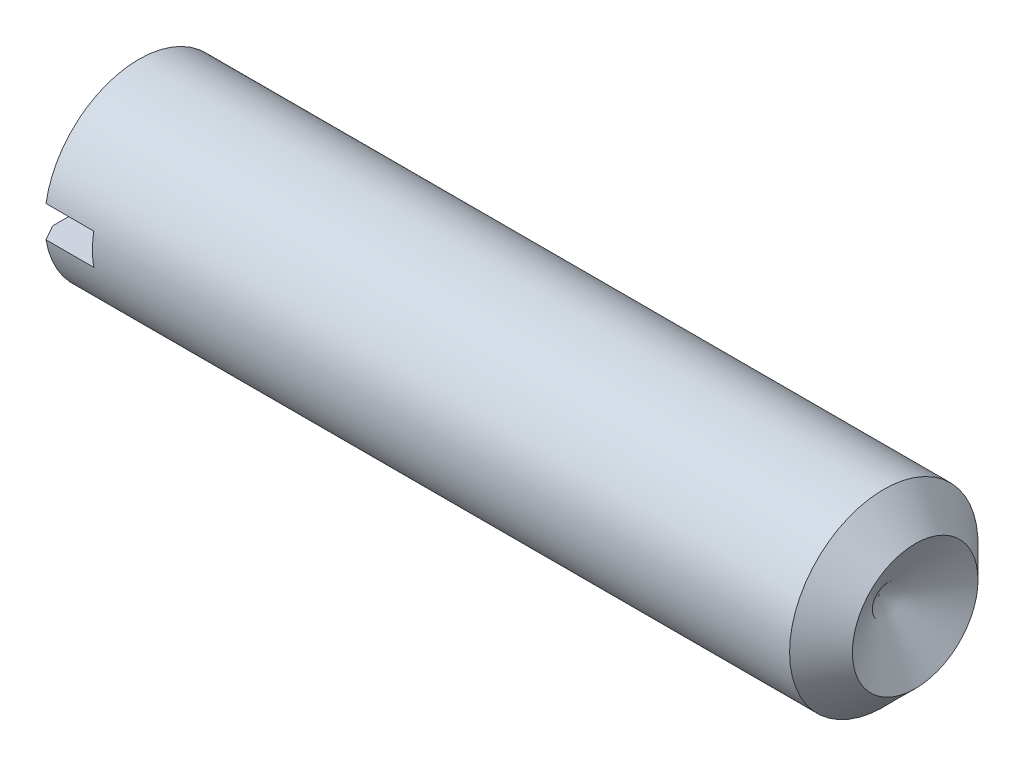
SolidWorks part; units mm, degrees
ref_plane "Plane1" through (0, 0, 0) normal (0, 0, 1) x (1, 0, 0)
ref_plane "Plane2" through (0, 0, 0) normal (0, 1, 0) x (1, 0, 0)
ref_plane "Plane3" through (0, 0, 0) normal (1, 0, 0) x (0, 0, -1)
sketch "BodySke" plane through (0, 0, 0) normal (0, 0, 1) x (1, 0, 0)
  line L0 (0.5566, -6) -> (47.1574, -6) construction
  line L1 (50, 4) -> (47.6906, 0)
  line L2 (0.5566, 6) -> (48, 6)
  line L3 (50, 4) -> (48, 6)
  line L4 (47.6906, 0) -> (0, 0)
  line L5 (-12.7, 0) -> (88.9, 0) construction
  line L6 (50, 4) -> (50, 19.05) construction
  line L7 (50, -4) -> (48, -6) construction
  line L8 (1.75, 12.7) -> (1.75, -3.175) construction
  line L9 (0, 0) -> (0, 5.036)
  line L10 (0, 5.036) -> (0.5566, 6)
  line L11 (0, -5.036) -> (0.5566, -6) construction
  line L12 (50, -4) -> (47.6906, 0) construction
  dimension "Length" = 50
  dimension "Diameter" = 12
  dimension "Drive_ch_ang" = 60
  dimension "Cup_ang" = 120
  dimension "Cup_dia" = 8
  dimension "Nose_ch_ang" = 45
  dimension "Advance" = 1.75
  dimension "Minor_dia" = 10.072
revolve "BaseBody" add sketch "BodySke"
extrude "Slot" cut sketch "Sketch2" along normal blind 3.6
sketch "Sketch2" plane through (0, 0, 0) normal (1, 0, 0) x (0, 0, -1)
  line L1 (6, -1) -> (-6, -1)
  line L2 (6, -1) -> (6, 1)
  line L3 (6, 1) -> (-6, 1)
  line L4 (-6, -1) -> (-6, 1)
  dimension "D1" = 12
  dimension "D2" = 1
  dimension "Slot_width" = 2
  dimension "D3" = 6
sketch "ThdSchSke" plane through (0, 0, 0) normal (0, 0, 1) x (1, 0, 0)
  line L0 (0.5566, -5.036) -> (-0.1184, -6)
  line L1 (0.5566, -5.036) -> (1.2316, -6)
  line L2 (1.2316, -6) -> (1.2316, -7.5)
  line L3 (-3.175, 0) -> (5.1513, 0) construction
  line L5 (1.2316, -7.5) -> (-0.1184, -7.5)
  line L6 (-0.1184, -7.5) -> (-0.1184, -6)
  line L7 (0.5566, -6) -> (0.5566, -1) construction
  dimension "Thread_minor" = 10.072
  dimension "Diameter" = 12
  dimension "SideAngle" = 55
  dimension "VeeAngle" = 70
  dimension "Overcut" = 15
revolve "ThreadSchematic" [suppressed] cut sketch "ThdSchSke" angle 360 about L3
pattern_linear "ThdSchPat" [suppressed]
equation "\"D1@Sketch2\" = \"Diameter@BodySke\""
equation "\"D3@Sketch2\" = \"D1@Sketch2\" / 2"
equation "\"D2@Sketch2\" = \"Slot_width@Sketch2\" / 2"
equation "\"Thread_minor@ThdSchSke\" = \"Minor_dia@BodySke\""
equation "\"Diameter@ThdSchSke\" = \"Diameter@BodySke\""
equation "\"Overcut@ThdSchSke\" = \"Diameter@BodySke\" * 1.25"
equation "\"Num_threads@ThdSchPat\" = int( (\"Length@BodySke\" - ( ( ( \"Diameter@BodySke\" - \"Minor_dia@BodySke\" ) * 0.5 ) / tan( \"Drive_ch_ang@BodySke\" * 0.017453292 ) ) - ( ( ( \"Diameter@BodySke\" - \"Cup_dia@BodySk"
equation "\"Advance@ThdSchPat\" = (\"Length@BodySke\" - ( ( ( \"Diameter@BodySke\" - \"Minor_dia@BodySke\" ) * 0.5 ) / tan( \"Drive_ch_ang@BodySke\" * 0.017453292 ) ) - ( ( ( \"Diameter@BodySke\" - \"Cup_dia@BodySke\" ) * 0."
equation "' \"Num_threads@ThdSchPat\" = \"Num_threads@ThdSchPat\" - sgn( \"Num_threads@ThdSchPat\" - 1) '---chamfered tips only---"
